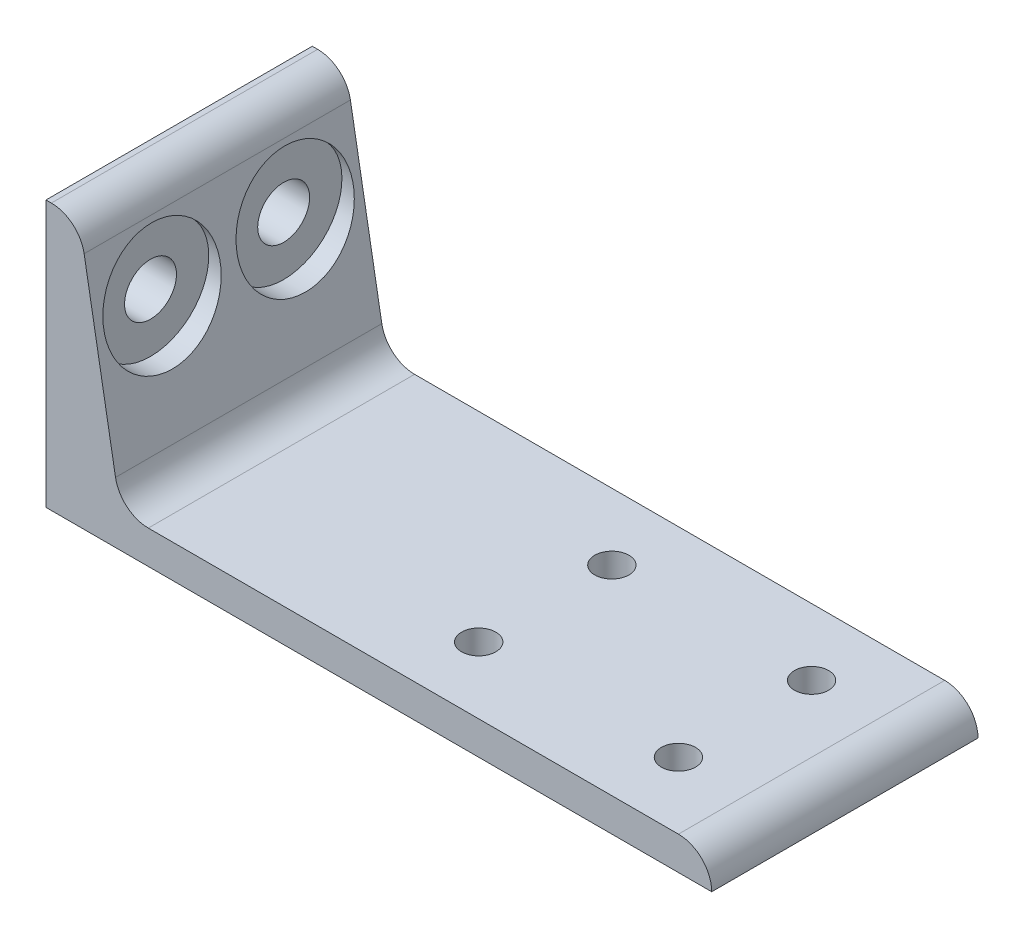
SolidWorks part; units mm, degrees
ref_plane "Front"
ref_plane "Top" through (0, 0, 0) normal (0, 1, 0) x (1, 0, 0)
ref_plane "Right" through (0, 0, 0) normal (1, 0, 0) x (0, 0, -1)
sketch "Sketch1" plane through (0, 0, 0) normal (0, 0, 1) x (1, 0, 0)
  line L0 (0, 0) -> (127, 0)
  line L2 (120.65, 6.35) -> (19.516, 6.35)
  line L3 (13.2625, 11.5973) -> (7.2752, 45.5527)
  line L4 (1.0217, 50.8) -> (0, 50.8)
  line L5 (0, 50.8) -> (0, 0)
  arc A0 (127, 0) -> (120.65, 6.35) centre (120.65, 0) ccw
  arc A1 (7.2752, 45.5527) -> (1.0217, 50.8) centre (1.0217, 44.45) ccw
  arc A2 (19.516, 6.35) -> (13.2625, 11.5973) centre (19.516, 12.7) cw
  point P10 (6.35, 50.8)
  dimension "D2" = 6.35
  dimension "D6" = 6.35
  dimension "D1" = 6.35
  dimension "D3" = 127
  dimension "D4" = 50.8
  dimension "D5" = 10
extrude "Extrude1" add sketch "Sketch1" along normal mid plane 50.8
sketch "Sketch2" plane through (0, 0, 0) normal (0, -1, 0) x (1, 0, 0)
  line L0 (0, 25.4) -> (127, 25.4) construction
  line L2 (0, 25.4) -> (0, -25.4) construction
  circle A0 centre (107.95, 12.7) radius 3.2639
  circle A1 centre (69.85, 12.7) radius 3.2639
  dimension "D1" = 69.85
  dimension "D2" = 107.95
  dimension "thru hole side dia" = 6.5278
  dimension "edge to hole" = 12.7
extrude "Cut-Extrude1" cut sketch "Sketch2" against normal up to next
sketch "Sketch3" plane through (0, 0, 0) normal (-1, 0, 0) x (0, 0, 1)
  line L0 (25.4, 50.8) -> (25.4, 0) construction
  line L1 (25.4, 0) -> (-25.4, 0) construction
  circle A0 centre (12.7, 33.3248) radius 4.953
  dimension "Bott Hole Thru" = 9.906
  dimension "Bott Hole Place Y" = 33.3248
  dimension "Bott Hole Place Z" = 12.7
extrude "Cut-Extrude2" cut sketch "Sketch3" against normal up to next
ref_plane "Plane1" through (14.732, 0, 0) normal (-1, 0, 0) x (0, 0, 1)
sketch "Sketch4" plane through (14.732, 0, 0) normal (-1, 0, 0) x (0, 0, 1)
  circle A0 centre (12.7, 33.3248) radius 11.1125
  dimension "Spotface Dia" = 22.225
extrude "Cut-Extrude3" cut sketch "Sketch4" along normal blind 7.493
pattern_linear "LPattern1"
